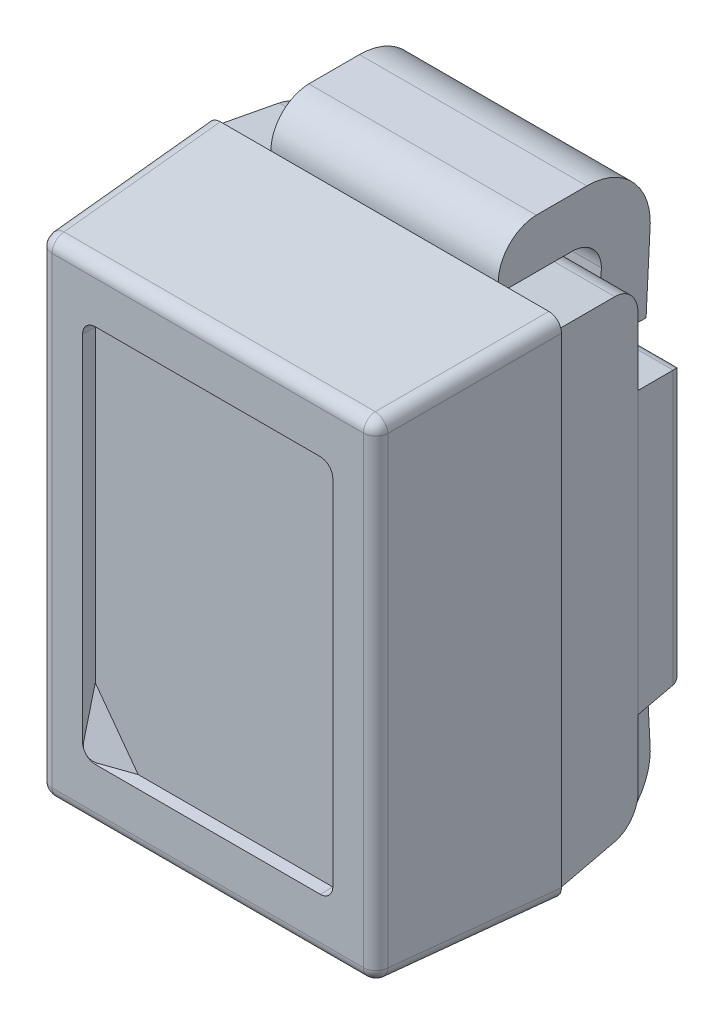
SolidWorks part; units mm, degrees
ref_plane "前基準面" through (0, 0, 0) normal (0, 0, 1) x (1, 0, 0)
ref_plane "上基準面" through (0, 0, 0) normal (0, 1, 0) x (1, 0, 0)
ref_plane "右基準面" through (0, 0, 0) normal (1, 0, 0) x (0, 0, -1)
imported_body "輸入1"
sketch "草圖1" plane through (0, 0, 0.65) normal (0, 0, 1) x (1, 0, 0)
  line L0 (-0.445, -0.75) -> (-0.325, -0.75)
  line L1 (-0.445, -0.75) -> (0.445, -0.75) construction
  line L2 (-0.495, -0.7) -> (-0.495, -0.52)
  line L3 (-0.495, 0.7) -> (-0.495, -0.7) construction
  line L4 (-0.495, -0.52) -> (-0.325, -0.75)
  arc A0 (-0.445, -0.75) -> (-0.495, -0.7) centre (-0.445, -0.7) cw
sketch "草圖3" plane through (0, 0, 0.7) normal (0, 0, 1) x (1, 0, 0)
  arc A0 (-0.495, -0.7) -> (-0.445, -0.75) centre (-0.445, -0.7) ccw construction
  point P0 (-0.4804, -0.7354)
sketch "草圖4" plane through (0, 0, 0.65) normal (0, 0, 1) x (1, 0, 0)
  line L0 (-0.495, -0.52) -> (-0.325, -0.75) construction
  point P0 (-0.41, -0.635)
sketch "草圖5" plane through (0, 0, 0.65) normal (0, 0, 1) x (1, 0, 0)
  line L0 (-0.41, -0.635) -> (-0.4804, -0.7354)
ref_plane "平面1" through (0.0236, -0.0165, 0) normal (0.8188, -0.574, 0) x (0, 0, -1)
sketch "草圖6" plane through (0.0236, -0.0165, 0) normal (0.8188, -0.574, 0) x (0, 0, -1)
  line L0 (-0.65, -0.7553) -> (-0.7, -0.8779)
other "邊界2"
